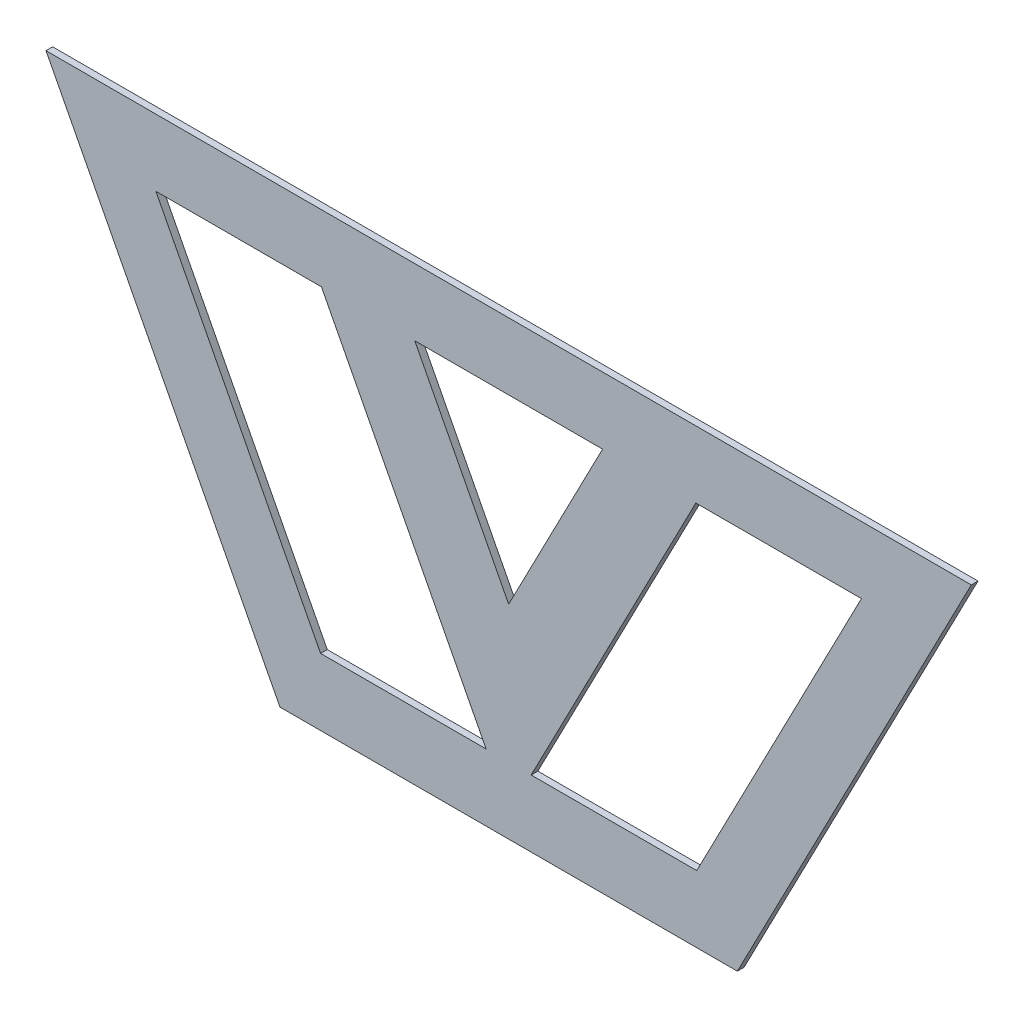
SolidWorks part; units mm, degrees
ref_plane "Front Plane" through (0, 0, 0) normal (0, 0, 1) x (1, 0, 0)
ref_plane "Top Plane" through (0, 0, 0) normal (0, 1, 0) x (1, 0, 0)
ref_plane "Right Plane" through (0, 0, 0) normal (1, 0, 0) x (0, 0, -1)
sketch "Model" plane through (0, 0, 0) normal (0, 0, 1) x (1, 0, 0)
  line L0 (-217.6, 675.977) -> (-374.1154, 978.0557)
  line L1 (-374.1154, 978.0557) -> (-216.7772, 978.0557)
  line L2 (139.8674, 675.977) -> (296.3827, 978.0557)
  line L3 (139.8674, 675.977) -> (-17.4708, 675.977)
  line L4 (-60.2618, 675.977) -> (-216.7772, 978.0557)
  line L5 (-60.2618, 675.977) -> (-217.6, 675.977)
  line L7 (-17.4708, 675.977) -> (139.0445, 978.0557)
  line L8 (-93.5609, 740.2451) -> (-250.0763, 1042.3238) construction
  line L9 (15.8283, 740.2451) -> (172.3436, 1042.3238) construction
  line L11 (139.8674, 675.977) -> (-217.6, 675.977) construction
  line L16 (-38.8663, 805.8408) -> (-128.0956, 978.0557)
  line L18 (-38.8663, 805.8408) -> (50.363, 978.0557)
  line L20 (-128.0956, 978.0557) -> (50.363, 978.0557)
  line L21 (-374.1154, 978.0557) -> (296.3827, 978.0557) construction
  line L22 (139.0445, 978.0557) -> (296.3827, 978.0557)
  line L28 (178.4836, 612.477) -> (-256.2163, 612.477)
  line L29 (-256.2163, 612.477) -> (-478.5338, 1041.5557)
  line L30 (178.4836, 612.477) -> (400.8012, 1041.5557)
  line L31 (-478.5338, 1041.5557) -> (400.8012, 1041.5557)
  dimension "D1" = 63.5
  dimension "D2" = 139.7
  dimension "D3" = 139.7
extrude "Boss-Extrude1" add sketch "Model" along normal blind 6.35
